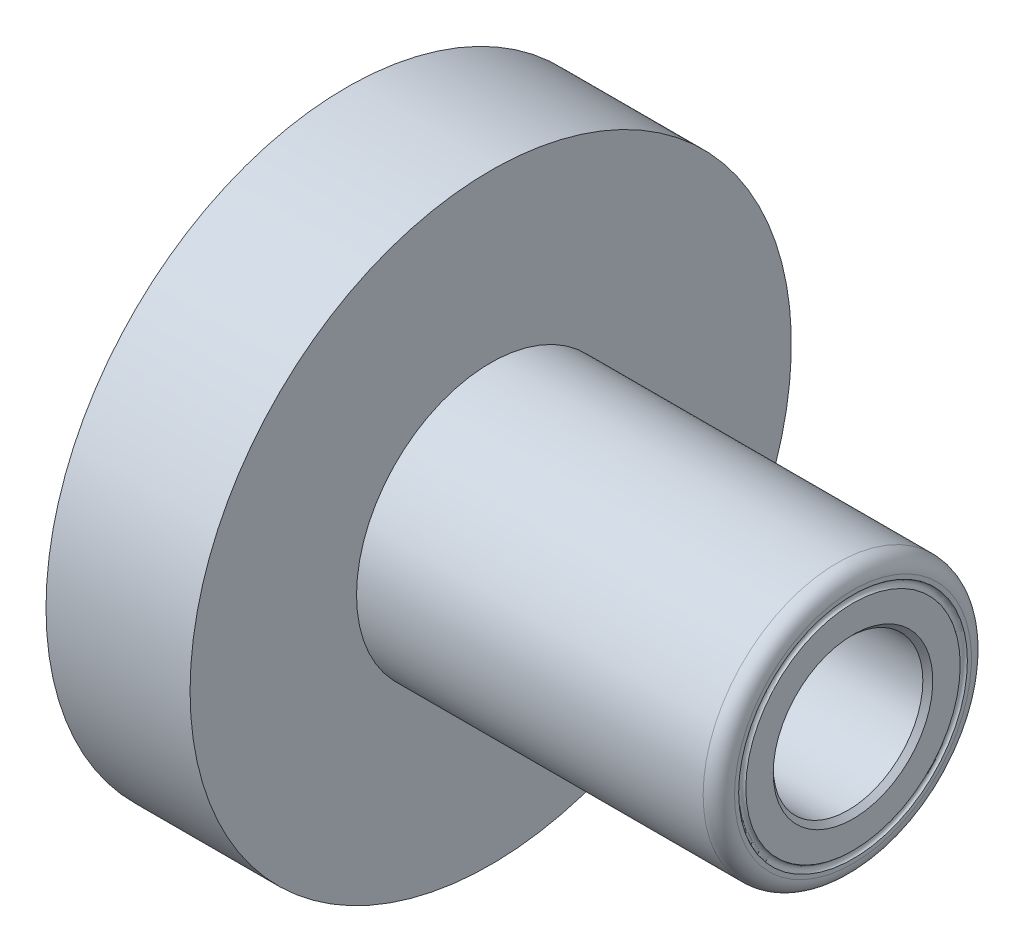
SolidWorks part; units mm, degrees
ref_plane "Front Plane" through (0, 0, 0) normal (0, 0, 1) x (1, 0, 0)
ref_plane "Top Plane" through (0, 0, 0) normal (0, 1, 0) x (1, 0, 0)
ref_plane "Right Plane" through (0, 0, 0) normal (1, 0, 0) x (0, 0, -1)
sketch "Sketch1" plane through (0, 0, 0) normal (0, 0, 1) x (1, 0, 0)
  line L0 (0, 0) -> (102.3864, 0) construction
  line L1 (0, 9.906) -> (0, 30.1625)
  line L2 (0, 30.1625) -> (14.4526, 30.1625)
  line L3 (14.4526, 30.1625) -> (14.4526, 13.462)
  line L4 (14.4526, 13.462) -> (49.2252, 13.462)
  line L5 (50.8, 11.8872) -> (50.8, 0)
  line L6 (50.8, 0) -> (30.9372, 0)
  line L7 (0, 9.906) -> (30.9372, 9.906)
  line L8 (30.9372, 9.906) -> (30.9372, 0)
  arc A0 (50.8, 11.8872) -> (49.2252, 13.462) centre (49.2252, 11.8872) ccw
  dimension "D5" = 1.5748
  dimension "D1" = 14.4526
  dimension "D2" = 60.325
  dimension "D3" = 30.9372
  dimension "D4" = 19.812
  dimension "D6" = 50.8
  dimension "D7" = 26.924
revolve "Revolve1" add sketch "Sketch1" angle 360 about L0
sketch "Sketch2" plane through (0, 0, 0) normal (-1, 0, 0) x (0, 0, 1)
  line L0 (0, 0) -> (0, 9.7644) construction
  circle A0 centre (-19.939, 0) radius 3.2004
  circle A1 centre (19.939, 0) radius 3.2004
  dimension "D2" = 6.4008
  dimension "D1" = 39.878
extrude "Cut-Extrude1" cut sketch "Sketch2" against normal blind 7.9502
sketch "Sketch3" plane through (50.8, 0, 0) normal (1, 0, 0) x (0, 0, -1)
  circle A0 centre (0, 0) radius 7.505
  dimension "D1" = 15.01
extrude "Cut-Extrude2" cut sketch "Sketch3" against normal through all
chamfer "Chamfer1" distance 0.5 angle 45 1 edges at (50.8, 0, -7.505)
sketch "Sketch4" plane through (0, 0, 0) normal (0, 0, 1) x (1, 0, 0)
  line L0 (0, 0) -> (65.0538, 0) construction
  line L1 (0, 30.1625) -> (0, -30.1625) construction
  circle A0 centre (50.927, 11.115) radius 0.381
  dimension "D2" = 50.927
  dimension "D3" = 0.762
  dimension "D1" = 11.115
revolve "Cut-Revolve1" cut sketch "Sketch4" angle 360 about L0
